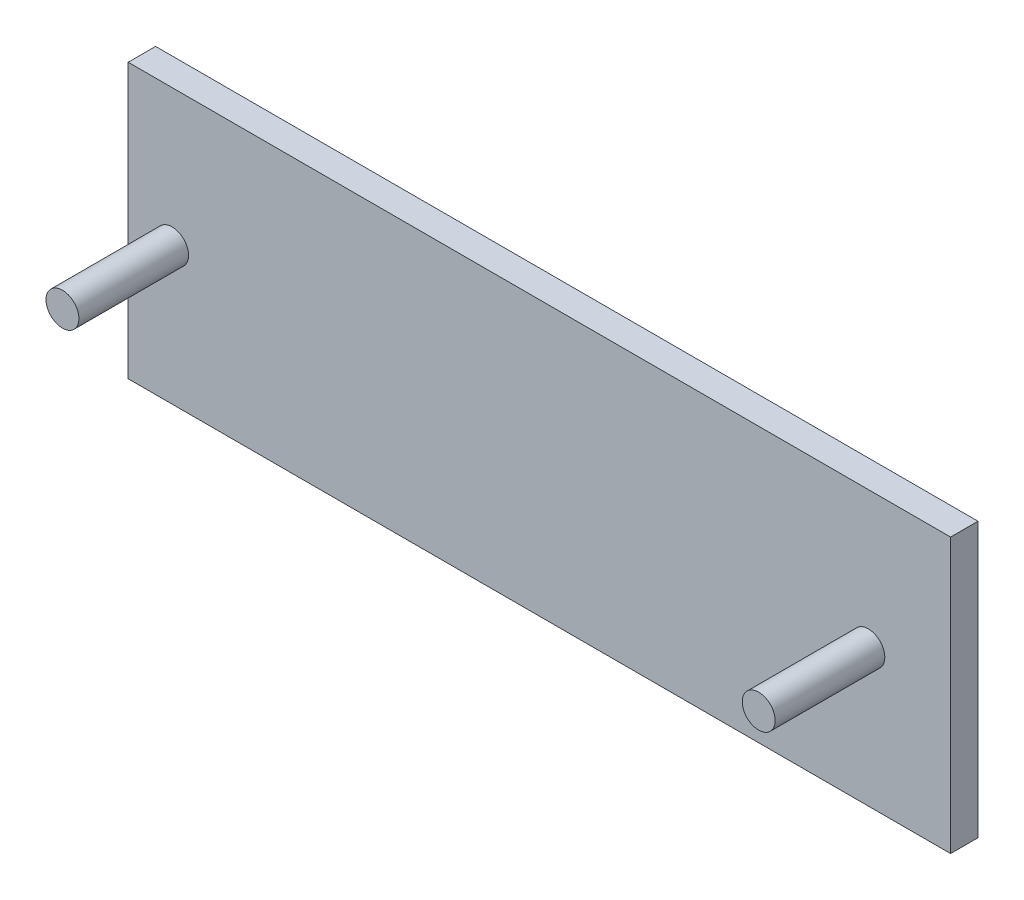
SolidWorks part; units mm, degrees
ref_plane "Ebene vorne" through (0, 0, 0) normal (0, 0, 1) x (1, 0, 0)
ref_plane "Ebene oben" through (0, 0, 0) normal (0, 1, 0) x (1, 0, 0)
ref_plane "Ebene rechts" through (0, 0, 0) normal (1, 0, 0) x (0, 0, -1)
sketch "Skizze1" plane through (0, 0, 0) normal (0, 0, 1) x (1, 0, 0)
  line L0 (0, 0) -> (300, 0)
  line L1 (300, 0) -> (300, 100)
  line L2 (300, 100) -> (0, 100)
  line L3 (0, 100) -> (0, 0)
extrude "Linear austragen1" add sketch "Skizze1" along normal blind 10
sketch "Skizze2" plane through (0, 0, 10) normal (0, 0, 1) x (1, 0, 0)
  line L0 (0, 0) -> (300, 0) construction
  line L1 (0, 100) -> (0, 0) construction
  circle A0 centre (16.018, 50) radius 6
  dimension "D1" = 50
  dimension "D2" = 16.018
extrude "Linear austragen2" add sketch "Skizze2" along normal blind 40
sketch "Skizze3" plane through (0, 0, 10) normal (0, 0, 1) x (1, 0, 0)
  circle A0 centre (270, 50) radius 6
extrude "Linear austragen3" add sketch "Skizze3" along normal blind 40
